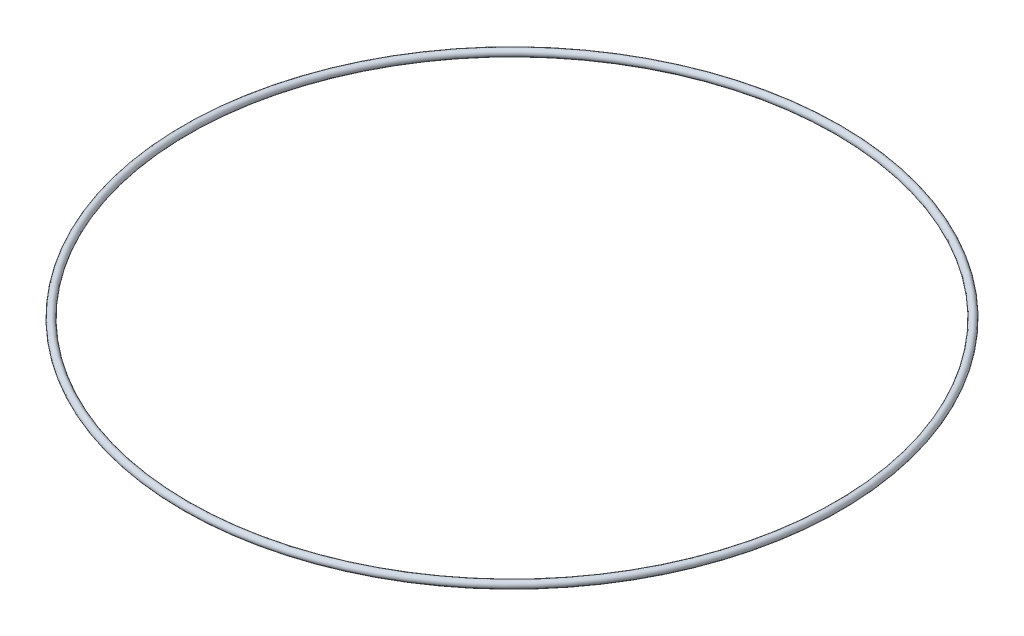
SolidWorks part; units mm, degrees
ref_plane "Plan1" through (0, 0, 0) normal (0, 0, 1) x (1, 0, 0)
ref_plane "Plan2" through (0, 0, 0) normal (0, 1, 0) x (1, 0, 0)
ref_plane "Plan3" through (0, 0, 0) normal (1, 0, 0) x (0, 0, -1)
sketch "Esquisse1" plane through (0, 0, 0) normal (0, 0, 1) x (1, 0, 0)
  line L1 (0, 0) -> (270, 0) construction
  line L2 (0, 1.5) -> (0, -1.5) construction
  circle A0 centre (136.5, 0) radius 1.5
  dimension "D2" = 136.5
  dimension "D1" = 3
  dimension "Diamètre du tore" = 3
  dimension "Diamètre intérieur" = 270
revolve "Base-Révolution" add sketch "Esquisse1" angle 360 about L2
equation " \"D1@Esquisse1\"=\"Diamètre du tore@Esquisse1\" "
equation "\"D2@Esquisse1\" = (\"Diamètre intérieur@Esquisse1\"/2)+(\"Diamètre du tore@Esquisse1\"/2)"
